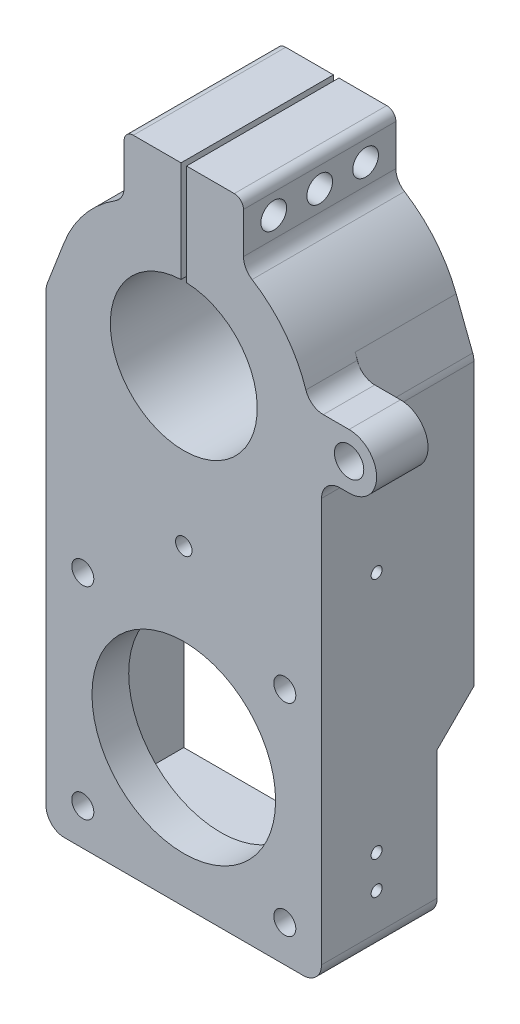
SolidWorks part; units mm, degrees
ref_plane "前视基准面" through (0, 0, 0) normal (0, 0, 1) x (1, 0, 0)
ref_plane "上视基准面" through (0, 0, 0) normal (0, 1, 0) x (1, 0, 0)
ref_plane "右视基准面" through (0, 0, 0) normal (1, 0, 0) x (0, 0, -1)
sketch "草图1" plane through (0, 0, 0) normal (0, 0, 1) x (1, 0, 0)
  line L0 (0, 0) -> (0, -75) construction
  line L1 (0, 0) -> (0, 180) construction
  line L2 (0, -75) -> (-65, -75)
  line L3 (0, -75) -> (65, -75)
  line L4 (0, 180) -> (0, 275) construction
  line L5 (0, 275) -> (27.5, 275)
  line L6 (0, 275) -> (-27.5, 275)
  line L7 (-32.5, 270) -> (-32.5, 247.7772)
  line L8 (32.5, 270) -> (32.5, 247.7772)
  line L9 (0, 180) -> (90, 180) construction
  line L10 (90, 195) -> (75.9934, 195)
  line L11 (90, 165) -> (85, 165)
  line L12 (-75, -65) -> (-75, 178.143)
  line L13 (75, -65) -> (75, 155)
  line L14 (-74.3333, 181.7332) -> (-65.3333, 205.1308)
  line L15 (0, 0) -> (55, 0) construction
  line L16 (55, 0) -> (55, -55) construction
  circle A0 centre (0, 95) radius 4.5
  circle A1 centre (0, 0) radius 50
  circle A2 centre (0, 180) radius 40
  arc A3 (66.4942, 201.875) -> (37.1875, 239.305) centre (0, 180) ccw
  arc A4 (90, 165) -> (90, 195) centre (90, 180) ccw
  circle A5 centre (90, 180) radius 8
  arc A6 (-37.1875, 239.305) -> (-65.3333, 205.1308) centre (0, 180) ccw
  arc A7 (75, 155) -> (85, 165) centre (85, 155) cw
  arc A8 (66.4942, 201.875) -> (75.9934, 195) centre (75.9934, 205) ccw
  arc A9 (32.5, 247.7772) -> (37.1875, 239.305) centre (42.5, 247.7772) ccw
  arc A10 (-32.5, 247.7772) -> (-37.1875, 239.305) centre (-42.5, 247.7772) cw
  arc A11 (-74.3333, 181.7332) -> (-75, 178.143) centre (-65, 178.143) ccw
  arc A12 (75, -65) -> (65, -75) centre (65, -65) cw
  arc A13 (-75, -65) -> (-65, -75) centre (-65, -65) ccw
  arc A14 (27.5, 275) -> (32.5, 270) centre (27.5, 270) cw
  arc A15 (-32.5, 270) -> (-27.5, 275) centre (-27.5, 270) cw
  circle A16 centre (55, -55) radius 6
  circle A17 centre (-55, -55) radius 6
  circle A18 centre (55, 55) radius 6
  circle A19 centre (-55, 55) radius 6
  point P35 (75, -75)
  point P38 (-75, -75)
  dimension "D2" = 9
  dimension "D5" = 5
  dimension "D4" = 10
extrude "凸台-拉伸1" add sketch "草图1" along normal blind 28
sketch "草图2" plane through (0, 0, 0) normal (0, 0, -1) x (-1, 0, 0)
  line L0 (-32.5, 247.7772) -> (-32.5, 270) construction
  line L1 (-27.5, 275) -> (27.5, 275) construction
  line L2 (32.5, 270) -> (32.5, 247.7772) construction
  line L3 (65.3333, 205.1308) -> (74.3333, 181.7332) construction
  line L4 (75, 178.143) -> (75, -65) construction
  line L5 (65, -75) -> (-65, -75) construction
  line L6 (-32.5, 247.7772) -> (-32.5, 270)
  line L7 (-27.5, 275) -> (27.5, 275)
  line L8 (32.5, 270) -> (32.5, 247.7772)
  line L9 (65.3333, 205.1308) -> (74.3333, 181.7332)
  line L10 (75, 178.143) -> (75, -65)
  line L11 (65, -75) -> (-65, -75)
  line L12 (0, 180) -> (0, 0) construction
  line L13 (-65.3333, 205.1308) -> (-74.3333, 181.7332)
  line L14 (-75, 178.143) -> (-75, -65)
  circle A0 centre (0, 180) radius 40 construction
  arc A1 (-37.1875, 239.305) -> (-32.5, 247.7772) centre (-42.5, 247.7772) ccw construction
  arc A2 (-27.5, 275) -> (-32.5, 270) centre (-27.5, 270) ccw construction
  arc A3 (32.5, 270) -> (27.5, 275) centre (27.5, 270) ccw construction
  arc A4 (32.5, 247.7772) -> (37.1875, 239.305) centre (42.5, 247.7772) ccw construction
  arc A5 (65.3333, 205.1308) -> (37.1875, 239.305) centre (0, 180) ccw construction
  arc A6 (75, 178.143) -> (74.3333, 181.7332) centre (65, 178.143) ccw construction
  arc A7 (65, -75) -> (75, -65) centre (65, -65) ccw construction
  arc A8 (-75, -65) -> (-65, -75) centre (-65, -65) ccw construction
  circle A9 centre (-55, -55) radius 6 construction
  circle A10 centre (55, -55) radius 6 construction
  circle A11 centre (0, 0) radius 50 construction
  circle A12 centre (55, 55) radius 6 construction
  circle A13 centre (0, 95) radius 4.5 construction
  circle A14 centre (-55, 55) radius 6 construction
  circle A15 centre (0, 180) radius 40
  arc A16 (-37.1875, 239.305) -> (-32.5, 247.7772) centre (-42.5, 247.7772) ccw
  arc A17 (-27.5, 275) -> (-32.5, 270) centre (-27.5, 270) ccw
  arc A18 (32.5, 270) -> (27.5, 275) centre (27.5, 270) ccw
  arc A19 (32.5, 247.7772) -> (37.1875, 239.305) centre (42.5, 247.7772) ccw
  arc A20 (65.3333, 205.1308) -> (37.1875, 239.305) centre (0, 180) ccw
  arc A21 (75, 178.143) -> (74.3333, 181.7332) centre (65, 178.143) ccw
  arc A22 (65, -75) -> (75, -65) centre (65, -65) ccw
  arc A23 (-75, -65) -> (-65, -75) centre (-65, -65) ccw
  circle A24 centre (-55, -55) radius 6
  circle A25 centre (55, -55) radius 6
  circle A26 centre (0, 0) radius 50
  circle A27 centre (55, 55) radius 6
  circle A28 centre (0, 95) radius 4.5
  circle A29 centre (-55, 55) radius 6
  arc A30 (-65.3333, 205.1308) -> (-37.1875, 239.305) centre (0, 180) cw
  arc A31 (-75, 178.143) -> (-74.3333, 181.7332) centre (-65, 178.143) cw
extrude "凸台-拉伸2" add sketch "草图2" along normal blind 55
sketch "草图3" plane through (0, 0, -55) normal (0, 0, -1) x (-1, 0, 0)
  line L0 (0, 0) -> (63, 0) construction
  line L1 (63, 109.8502) -> (63, -63)
  line L2 (63, -63) -> (-63, -63)
  line L3 (-63, -63) -> (-63, 109.8502)
  arc A0 (-39.5294, 122.2295) -> (39.5294, 122.2295) centre (0, 180) ccw
  arc A1 (-39.5294, 122.2295) -> (-63, 109.8502) centre (-48, 109.8502) ccw
  arc A2 (39.5294, 122.2295) -> (63, 109.8502) centre (48, 109.8502) cw
  dimension "D1" = 15
  dimension "D2" = 15
extrude "切除-拉伸1" cut sketch "草图3" against normal blind 63
sketch "草图4" plane through (0, 275, 0) normal (0, 1, 0) x (1, 0, 0)
  line L1 (1.5, 58.7601) -> (-1.5, 58.7601)
  line L2 (1.5, 58.7601) -> (1.5, -58.7601)
  line L3 (1.5, -58.7601) -> (-1.5, -58.7601)
  line L4 (-1.5, 58.7601) -> (-1.5, -58.7601)
  line L5 (1.5, 58.7601) -> (-1.5, -58.7601) construction
  line L6 (1.5, -58.7601) -> (-1.5, 58.7601) construction
  point P0 (0, 0)
  dimension "D1" = 3
extrude "切除-拉伸2" cut sketch "草图4" against normal blind 63
sketch "草图5" plane through (32.5, 0, 0) normal (1, 0, 0) x (0, 0, -1)
  line L0 (55, 275) -> (-28, 275) construction
  line L1 (-28, 275) -> (55, 275) construction
  line L2 (55, 270) -> (55, 247.7772) construction
  line L3 (-28, 247.7772) -> (-28, 270) construction
  line L4 (55, 219.9719) -> (55, 275) construction
  circle A0 centre (13.5, 259) radius 7
  circle A1 centre (-11.5, 259) radius 7
  circle A2 centre (38.5, 259) radius 7
  dimension "D1" = 16
  dimension "D2" = 16
  dimension "D3" = 16
  dimension "D4" = 16.5
  dimension "D5" = 16.5
  dimension "D6" = 41.5
extrude "切除-拉伸3" cut sketch "草图5" against normal blind 10
sketch "草图6" plane through (22.5, 0, 0) normal (1, 0, 0) x (0, 0, -1)
  circle A0 centre (-11.5, 259) radius 4.5
  circle A1 centre (13.5, 259) radius 4.5
  circle A2 centre (38.5, 259) radius 4.5
extrude "切除-拉伸4" cut sketch "草图6" against normal up to surface and the other way through all
sketch "草图7" plane through (75, 0, 0) normal (1, 0, 0) x (0, 0, -1)
  line L0 (-28, -75) -> (55, -75) construction
  line L1 (35, -75) -> (55, -75)
  line L2 (55, -75) -> (55, 5) construction
  line L3 (55, 5) -> (35, 5) construction
  line L4 (35, 5) -> (55, 25)
  line L5 (35, 5) -> (35, -75)
  line L6 (55, 178.143) -> (55, -65) construction
  line L7 (55, 25) -> (55, -75)
extrude "切除-拉伸5" cut sketch "草图7" against normal blind 150
sketch "草图8" plane through (75, 0, 0) normal (1, 0, 0) x (0, 0, -1)
  line L0 (-28, -65) -> (-28, 155) construction
  line L1 (-28, -75) -> (35, -75) construction
  circle A0 centre (2, -45) radius 3
  circle A1 centre (2, -27) radius 3
  circle A2 centre (2, 105) radius 3
  dimension "D1" = 30
  dimension "D2" = 30
  dimension "D3" = 30
  dimension "D4" = 30
  dimension "D5" = 18
  dimension "D6" = 132
extrude "切除-拉伸6" cut sketch "草图8" against normal blind 12
sketch "草图9" plane through (-125.6472, 48.3309, 0) normal (-0.9333, 0.359, 0) x (0, 0, 1)
  line L0 (28, 168) -> (28, 142.931) construction
  circle A0 centre (-2, 170.4659) radius 2.5
  circle A1 centre (-2, 148.4659) radius 2.5
  dimension "D1" = 22
  dimension "D2" = 30
extrude "切除-拉伸7" cut sketch "草图9" against normal blind 15
